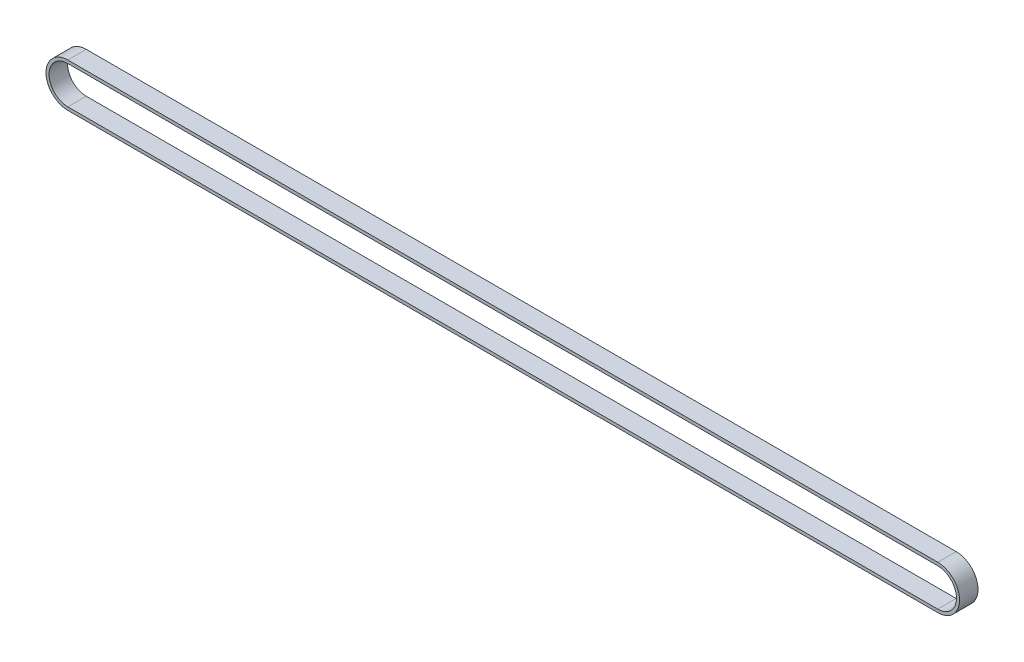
SolidWorks part; units mm, degrees
ref_plane "Спереди" through (0, 0, 0) normal (0, 0, 1) x (1, 0, 0)
ref_plane "Сверху" through (0, 0, 0) normal (0, 1, 0) x (1, 0, 0)
ref_plane "Справа" through (0, 0, 0) normal (1, 0, 0) x (0, 0, -1)
sketch "Эскиз1" plane through (0, 0, 0) normal (0, 0, 1) x (1, 0, 0)
  line L0 (0, 6.1) -> (283, 6.1)
  line L1 (0, -6.1) -> (283, -6.1)
  line L2 (0, 7.1) -> (283, 7.1)
  line L3 (0, -7.1) -> (283, -7.1)
  arc A0 (0, 6.1) -> (0, -6.1) centre (0, 0) ccw
  arc A1 (283, -6.1) -> (283, 6.1) centre (283, 0) ccw
  arc A2 (283, -7.1) -> (283, 7.1) centre (283, 0) ccw
  arc A3 (0, 7.1) -> (0, -7.1) centre (0, 0) ccw
  dimension "D1" = 283
  dimension "D2" = 6.1
  dimension "D3" = 1
extrude "Бобышка-Вытянуть1" add sketch "Эскиз1" along normal blind 6
